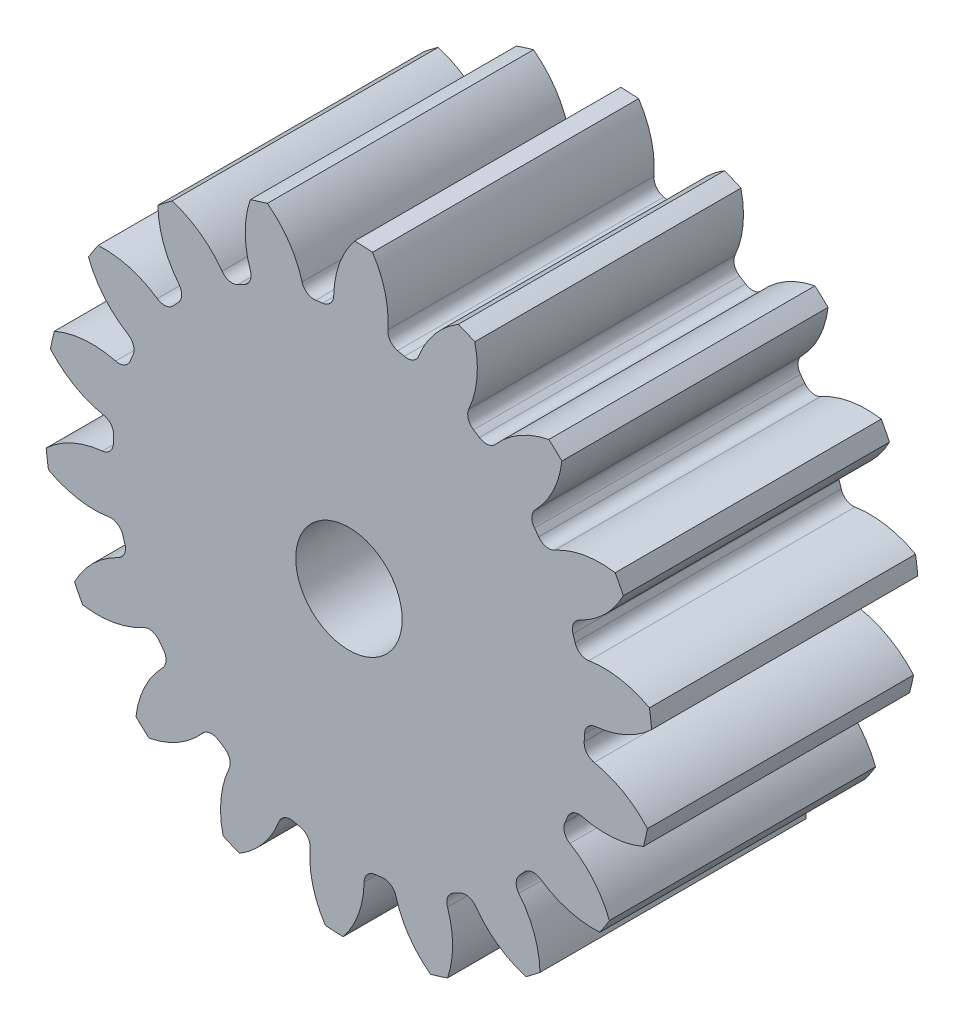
SolidWorks part; units mm, degrees
ref_plane "Front" through (0, 0, 0) normal (0, 0, 1) x (1, 0, 0)
ref_plane "Top" through (0, 0, 0) normal (0, 1, 0) x (1, 0, 0)
ref_plane "Right" through (0, 0, 0) normal (1, 0, 0) x (0, 0, -1)
sketch "Sketch3" plane through (0, 0, 0) normal (0, 0, 1) x (1, 0, 0)
  circle A0 centre (0, 0) radius 101.6
  dimension "od" = 203.2
extrude "gearBody" add sketch "Sketch3" along normal blind 88.9
sketch "Sketch2" plane through (0, 0, 0) normal (0, 0, 1) x (1, 0, 0)
  line L0 (0, 0) -> (79.3848, 32.8823) construction
  line L1 (100.1362, -20.0316) -> (0, 0) construction
  line L2 (0, 0) -> (36.3143, 0) construction
  line L3 (91.3709, 3.5548) -> (90.6037, -12.3389) construction
  line L5 (90.9873, -4.3921) -> (0, 0) construction
  line L7 (0, 0) -> (85.9255, 0) construction
  arc A0 (85.905, 1.8782) -> (85.3247, -10.1436) centre (0, 0) ccw construction
  arc A1 (101.1229, 9.8341) -> (99.7056, -19.5283) centre (0, 0) ccw construction
  arc A2 (91.3709, 3.5548) -> (90.6037, -12.3389) centre (0, 0) ccw construction
  arc A3 (78.5836, -4.9611) -> (78.696, -2.631) centre (0, 0) ccw
  arc A4 (100.1362, -20.0316) -> (81.9183, -9.2802) centre (75.8486, -40.3756) ccw
  arc A5 (100.1362, -20.0316) -> (101.6, 10.2935) centre (0, 0) ccw
  arc A6 (101.6, 10.2935) -> (82.4312, 1.3468) centre (79.3848, 32.8823) cw
  arc A7 (78.696, -2.631) -> (82.4312, 1.3468) centre (82.8288, -2.7691) cw
  arc A8 (81.9183, -9.2802) -> (78.5836, -4.9611) centre (82.7105, -5.2216) cw
  point P6 (101.6, 10.2935)
  point P22 (100.1362, -20.0316)
  dimension "baseDia" = 171.851
  dimension "od" = 203.2
  dimension "pd" = 182.88
  dimension "rd" = 157.48
  dimension "rFillet" = 4.1351
  dimension "pointX" = 101.6
  dimension "pointY" = 10.2935
  dimension "CTT" = 15.8937
  dimension "flankCenterAngle" = 22.5
extrude "toothCut" cut sketch "Sketch2" along normal through all
pattern_circular "CirPattern1" count 18 over 360 about axis through (0, 0, 0) along (0, 0, 1) of "toothCut"
sketch "hub1Dia" plane through (0, 0, 0) normal (0, 0, -1) x (-1, 0, 0)
  circle A0 centre (0, 0) radius 12.7
  dimension "hub1Dia" = 25.4
sketch "hub2Dia" plane through (0, 0, 88.9) normal (0, 0, 1) x (1, 0, 0)
  circle A0 centre (0, 0) radius 12.7
  dimension "hub2dia" = 25.4
sketch "boreDia" plane through (0, 0, 0) normal (0, 0, 1) x (1, 0, 0)
  circle A0 centre (0, 0) radius 17.78
  dimension "boreDia" = 35.56
extrude "bore" cut sketch "boreDia" against normal mid plane 25400
